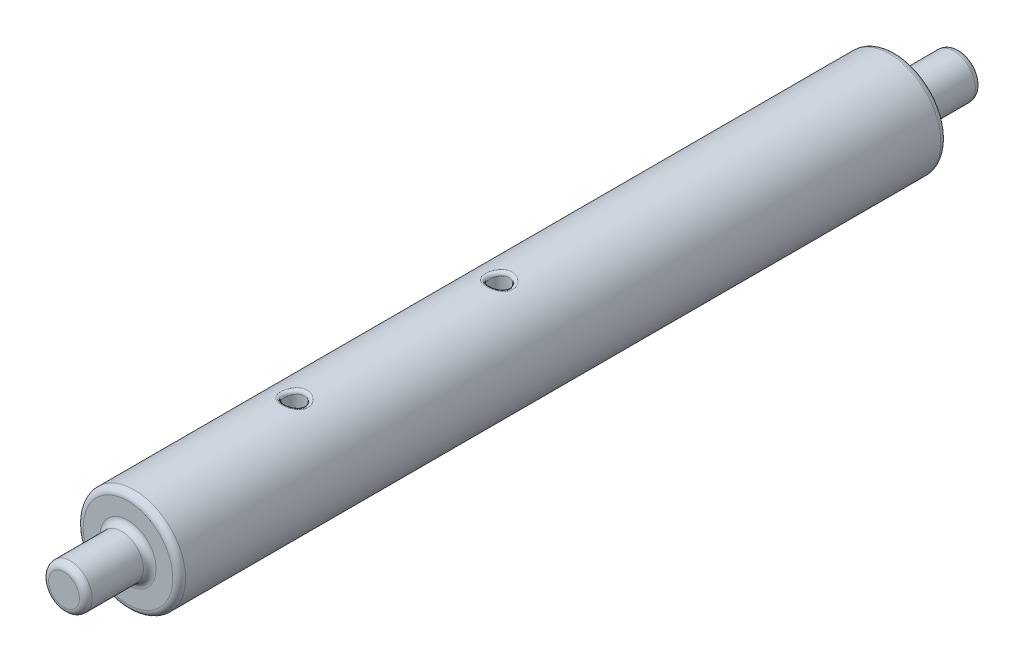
SolidWorks part; units mm, degrees
ref_plane "Спереди" through (0, 0, 0) normal (0, 0, 1) x (1, 0, 0)
ref_plane "Сверху" through (0, 0, 0) normal (0, 1, 0) x (1, 0, 0)
ref_plane "Справа" through (0, 0, 0) normal (1, 0, 0) x (0, 0, -1)
sketch "Эскиз1" plane through (0, 0, 0) normal (1, 0, 0) x (0, 0, -1)
  line L0 (-35, 0) -> (35, 0)
  line L1 (35, 0) -> (35, 1.7)
  line L2 (35, 1.7) -> (30, 1.7)
  line L3 (30, 1.7) -> (30, 4)
  line L4 (30, 4) -> (-30, 4)
  line L5 (-30, 4) -> (-30, 1.7)
  line L6 (-30, 1.7) -> (-35, 1.7)
  line L7 (-35, 1.7) -> (-35, 0)
  dimension "D1" = 1.7
  dimension "D2" = 5
  dimension "D3" = 60
  dimension "D4" = 4
revolve "Повернуть1" add sketch "Эскиз1" angle 360 about L0
fillet "Скругление1" radius 0.5 6 edges at (4, 0, -30) (4, 0, 30) (1.7, 0, -35) (1.7, 0, -30) (1.7, 0, 30) (1.7, 0, 35)
sketch "Эскиз2" plane through (0, 0, 0) normal (0, 1, 0) x (1, 0, 0)
  line L0 (-2.2, -30) -> (2.2, -30) construction
  circle A0 centre (0, -17) radius 0.75
  circle A1 centre (0, -1) radius 0.75
  dimension "D1" = 1.5
  dimension "D2" = 13
  dimension "D3" = 29
extrude "Вырез-Вытянуть1" cut sketch "Эскиз2" against normal mid plane 10
fillet "Скругление2" radius 0.25 4 edges at (-0.1578, -3.9969, 16.2668) (0.1578, 3.9969, 16.2668) (-0.1578, -3.9969, 0.2668) (0.1578, 3.9969, 0.2668)
